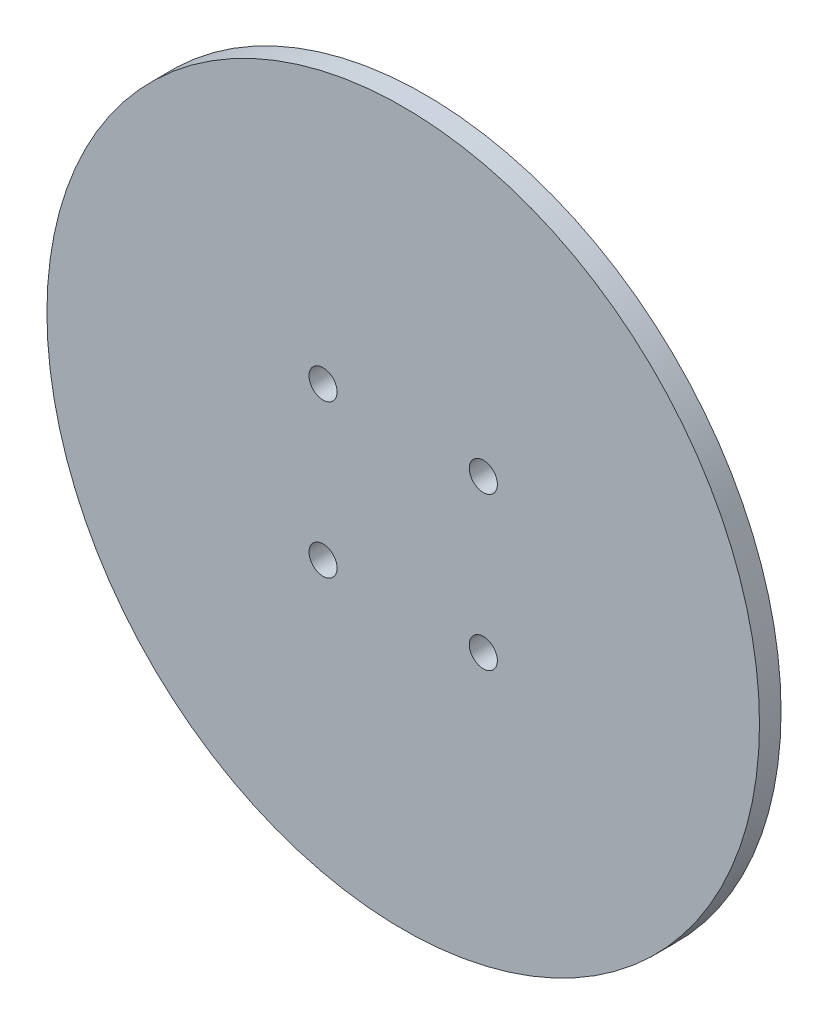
SolidWorks part; units mm, degrees
ref_plane "正面" through (0, 0, 0) normal (0, 0, 1) x (1, 0, 0)
ref_plane "平面" through (0, 0, 0) normal (0, 1, 0) x (1, 0, 0)
ref_plane "右側面" through (0, 0, 0) normal (1, 0, 0) x (0, 0, -1)
sketch "ｽｹｯﾁ1" plane through (0, 0, 0) normal (0, 0, 1) x (1, 0, 0)
  circle A0 centre (0, 0) radius 66
  dimension "D1" = 132
extrude "ﾎﾞｽ - 押し出し3" add sketch "ｽｹｯﾁ1" along normal blind 4
sketch "ｽｹｯﾁ15" plane through (0, 0, 0) normal (0, 0, -1) x (-1, 0, 0)
  circle A0 centre (-14.8459, 14.1368) radius 2.6
  circle A1 centre (14.8459, 14.1368) radius 2.6
  circle A2 centre (14.8459, -14.1368) radius 2.6
  circle A3 centre (-14.8459, -14.1368) radius 2.6
  dimension "D2" = 5.2
  dimension "D5" = 20.5
  dimension "D6" = 20.5
  dimension "D7" = 20.5
  dimension "D8" = 20.5
extrude "ｶｯﾄ - 押し出し1" cut sketch "ｽｹｯﾁ15" against normal through all
ref_plane "平面1" through (0, 50, 0) normal (0, 1, 0) x (1, 0, 0)
ref_plane "平面2" through (50, 0, 0) normal (1, 0, 0) x (0, 0, -1)
ref_plane "平面4" through (0, -50, 0) normal (0, 1, 0) x (1, 0, 0)
ref_plane "平面5" through (-50, 0, 0) normal (1, 0, 0) x (0, 0, -1)
sketch "ｽｹｯﾁ17" plane through (0, 0, 0) normal (0, 0, -1) x (-1, 0, 0)
  circle A0 centre (0, 0) radius 3.05
